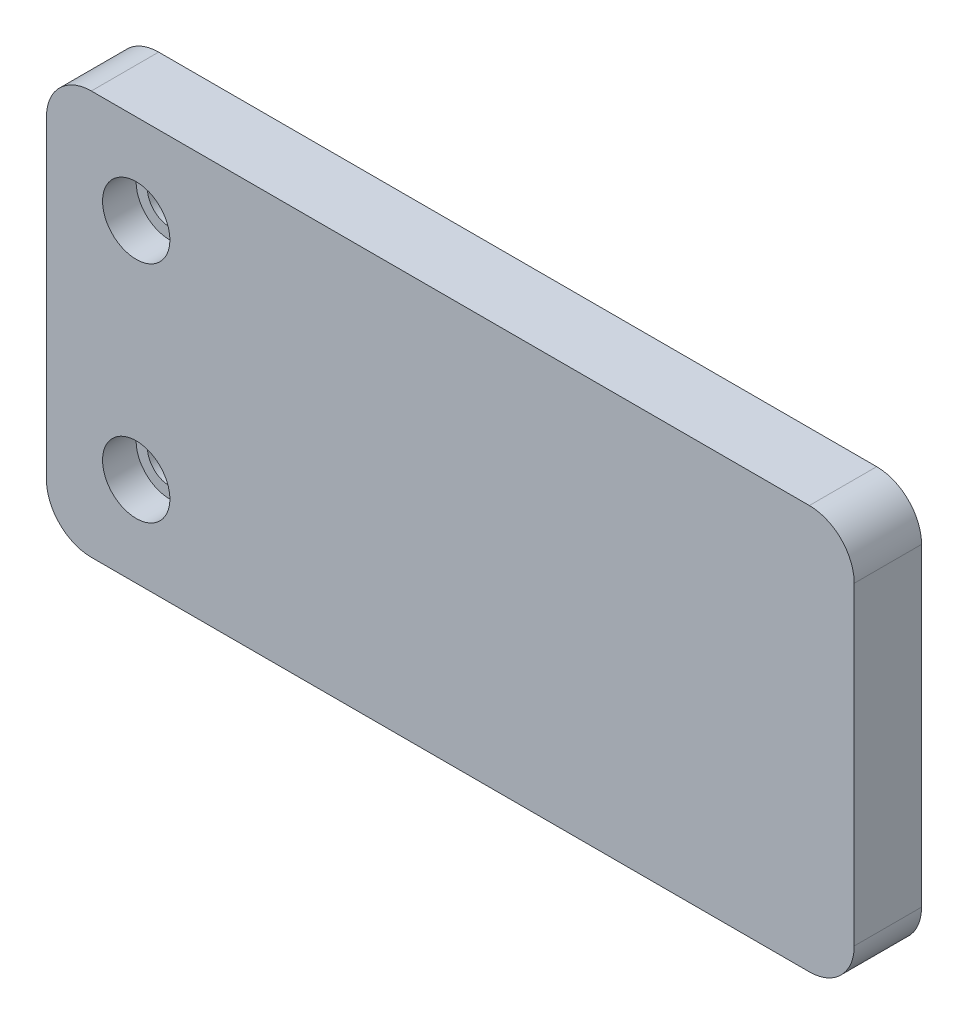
SolidWorks part; units mm, degrees
ref_plane "Front Plane" through (0, 0, 0) normal (0, 0, 1) x (1, 0, 0)
ref_plane "Top Plane" through (0, 0, 0) normal (0, 1, 0) x (1, 0, 0)
ref_plane "Right Plane" through (0, 0, 0) normal (1, 0, 0) x (0, 0, -1)
sketch "Sketch1" plane through (0, 0, 0) normal (0, 0, 1) x (1, 0, 0)
  line L0 (0, 0) -> (114.3, 0)
  line L1 (114.3, 0) -> (114.3, 57.15)
  line L2 (114.3, 57.15) -> (0, 57.15)
  line L3 (0, 57.15) -> (0, 0)
  circle A0 centre (12.7, 12.7) radius 3.175
  circle A1 centre (12.7, 12.7) radius 4.7625
  circle A2 centre (12.7, 44.45) radius 3.175
  circle A3 centre (12.7, 44.45) radius 4.7625
  dimension "D6" = 6.35
  dimension "D7" = 9.525
  dimension "D1" = 114.3
  dimension "D2" = 57.15
  dimension "D3" = 12.7
  dimension "D4" = 12.7
  dimension "D5" = 31.75
sketch "Sketch2" plane through (0, 0, 0) normal (0, 0, 1) x (1, 0, 0)
  line L0 (0, 0) -> (114.3, 0) construction
  line L1 (114.3, 0) -> (114.3, 57.15) construction
  line L2 (114.3, 57.15) -> (0, 57.15) construction
  line L3 (0, 57.15) -> (0, 0) construction
  line L4 (0, 0) -> (114.3, 0)
  line L5 (114.3, 0) -> (114.3, 57.15)
  line L6 (114.3, 57.15) -> (0, 57.15)
  line L7 (0, 57.15) -> (0, 0)
  circle A0 centre (12.7, 12.7) radius 3.175 construction
  circle A1 centre (12.7, 44.45) radius 3.175 construction
  circle A2 centre (12.7, 12.7) radius 3.175
  circle A3 centre (12.7, 44.45) radius 3.175
extrude "Boss-Extrude1" add sketch "Sketch2" along normal blind 9.525
sketch "Sketch3" plane through (0, 0, 0) normal (0, 0, 1) x (1, 0, 0)
  circle A0 centre (12.7, 44.45) radius 4.7625 construction
  circle A1 centre (12.7, 12.7) radius 4.7625 construction
  circle A2 centre (12.7, 44.45) radius 4.7625
  circle A3 centre (12.7, 12.7) radius 4.7625
extrude "Cut-Extrude1" cut sketch "Sketch3" along normal blind 9.525 from offset 4.7752
fillet "Fillet1" radius 6.35 4 edges at (114.3, 57.15, 4.7625) (114.3, 0, 4.7625) (0, 0, 4.7625) (0, 57.15, 4.7625)
